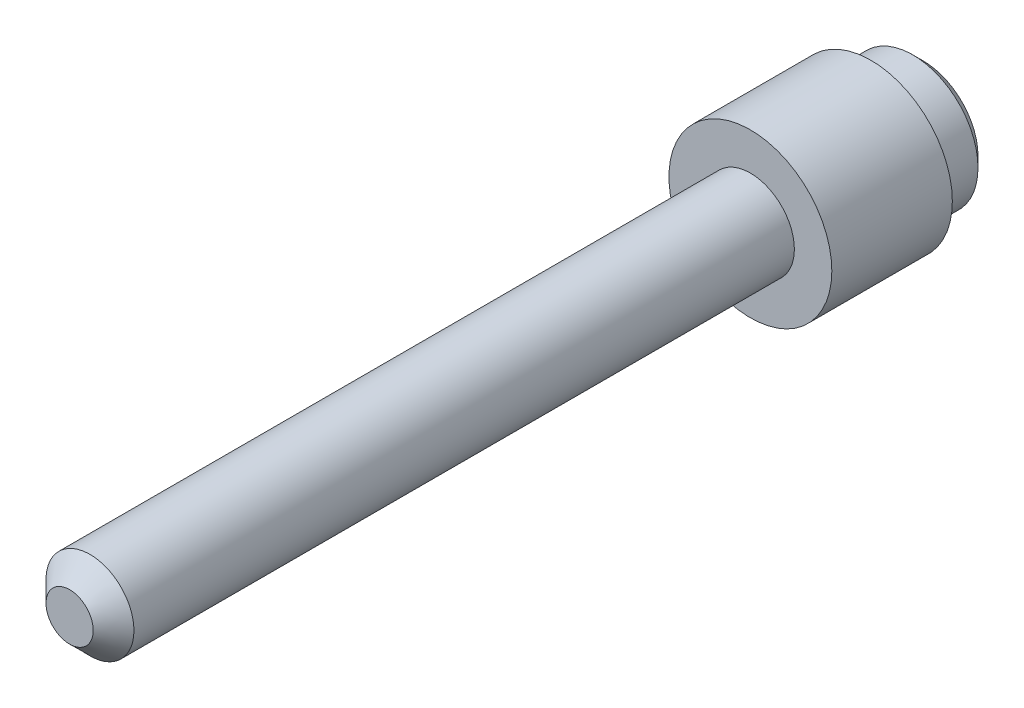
SolidWorks part; units mm, degrees
ref_plane "Спереди" through (0, 0, 0) normal (0, 0, 1) x (1, 0, 0)
ref_plane "Сверху" through (0, 0, 0) normal (0, 1, 0) x (1, 0, 0)
ref_plane "Справа" through (0, 0, 0) normal (1, 0, 0) x (0, 0, -1)
sketch "Эскиз1" plane through (0, 0, 0) normal (1, 0, 0) x (0, 0, -1)
  line L0 (0, 0) -> (57.1501, 0) construction
  line L1 (0, 0) -> (0, 0.9207)
  line L2 (0.7937, 1.7145) -> (26.543, 1.7145)
  line L3 (26.543, 1.7145) -> (26.543, 3.175)
  line L4 (26.543, 3.175) -> (31.242, 3.175)
  line L5 (31.242, 3.175) -> (31.242, 2.54)
  line L6 (33.274, 2.1431) -> (32.8771, 2.54)
  line L7 (33.274, 2.1431) -> (33.274, 0)
  line L8 (33.274, 0) -> (0, 0)
  line L9 (32.8771, 2.54) -> (31.242, 2.54)
  line L10 (0, 0.9207) -> (0.7937, 1.7145)
  point P3 (0, 1.7145)
  dimension "D1" = 3.429
  dimension "D2" = 6.35
  dimension "D3" = 33.274
  dimension "D4" = 5.08
  dimension "D5" = 45
  dimension "D6" = 0.3969
  dimension "D7" = 4.699
  dimension "D8" = 6.731
revolve "Повернуть1" add sketch "Эскиз1" angle 360 about L0
